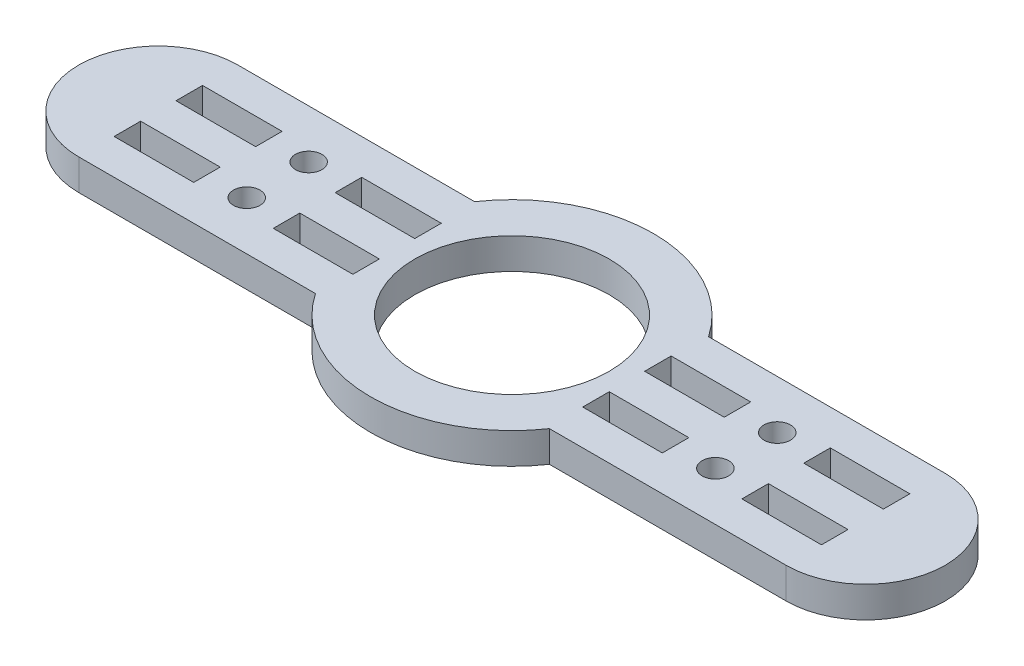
SolidWorks part; units mm, degrees
ref_plane "Front Plane" through (0, 0, 0) normal (0, 0, 1) x (1, 0, 0)
ref_plane "Top Plane" through (0, 0, 0) normal (0, 1, 0) x (1, 0, 0)
ref_plane "Right Plane" through (0, 0, 0) normal (1, 0, 0) x (0, 0, -1)
sketch "Sketch1" plane through (0, 0, 0) normal (0, 1, 0) x (1, 0, 0)
  line L0 (-40, 0) -> (40, 0) construction
  line L1 (-40, 9) -> (40, 9)
  line L2 (-40, -9) -> (40, -9)
  line L3 (-1032.6502, 3.5) -> (48967.3498, 3.5) construction
  line L4 (-1032.6502, -3.5) -> (48967.3498, -3.5) construction
  line L5 (-1000, 0) -> (49000, 0) construction
  line L6 (-22, -5) -> (-13, -5)
  line L7 (-22, -5) -> (-22, -2)
  line L8 (-22, -2) -> (-13, -2)
  line L9 (-13, -5) -> (-13, -2)
  line L10 (-22, -5) -> (-13, -2) construction
  line L11 (-22, -2) -> (-13, -5) construction
  line L12 (-40, -5) -> (-31, -5)
  line L13 (-40, -5) -> (-40, -2)
  line L14 (-40, -2) -> (-31, -2)
  line L15 (-31, -5) -> (-31, -2)
  line L16 (-40, -5) -> (-31, -2) construction
  line L17 (-40, -2) -> (-31, -5) construction
  line L18 (-40, 2) -> (-31, 5) construction
  line L19 (-40, 5) -> (-31, 2) construction
  line L20 (-22, 2) -> (-13, 5) construction
  line L21 (-22, 5) -> (-13, 2) construction
  line L22 (-31, 5) -> (-31, 2)
  line L23 (-40, 2) -> (-31, 2)
  line L24 (-40, 5) -> (-40, 2)
  line L25 (-40, 5) -> (-31, 5)
  line L26 (-13, 5) -> (-13, 2)
  line L27 (-22, 2) -> (-13, 2)
  line L28 (-22, 5) -> (-22, 2)
  line L29 (-22, 5) -> (-13, 5)
  line L30 (0, -1000) -> (0, 49000) construction
  line L31 (22, 5) -> (13, 2) construction
  line L32 (22, 2) -> (13, 5) construction
  line L33 (40, 5) -> (31, 2) construction
  line L34 (40, 2) -> (31, 5) construction
  line L35 (40, -2) -> (31, -5) construction
  line L36 (40, -5) -> (31, -2) construction
  line L37 (22, -2) -> (13, -5) construction
  line L38 (22, -5) -> (13, -2) construction
  line L39 (22, 5) -> (13, 5)
  line L40 (22, 5) -> (22, 2)
  line L41 (22, 2) -> (13, 2)
  line L42 (13, 5) -> (13, 2)
  line L43 (40, 5) -> (31, 5)
  line L44 (40, 5) -> (40, 2)
  line L45 (40, 2) -> (31, 2)
  line L46 (31, 5) -> (31, 2)
  line L47 (31, -5) -> (31, -2)
  line L48 (40, -2) -> (31, -2)
  line L49 (40, -5) -> (40, -2)
  line L50 (40, -5) -> (31, -5)
  line L51 (13, -5) -> (13, -2)
  line L52 (22, -2) -> (13, -2)
  line L53 (22, -5) -> (22, -2)
  line L54 (22, -5) -> (13, -5)
  circle A0 centre (0, 0) radius 11
  arc A1 (13.2288, 9) -> (-13.2288, 9) centre (0, 0) ccw
  arc A2 (-40, 9) -> (-40, -9) centre (-40, 0) ccw
  arc A3 (40, -9) -> (40, 9) centre (40, 0) ccw
  circle A4 centre (0, 0) radius 11 construction
  arc A5 (-13.2288, -9) -> (13.2288, -9) centre (0, 0) ccw
  circle A6 centre (-26.5, 3.5) radius 1.5
  circle A7 centre (-26.5, -3.5) radius 1.5
  circle A8 centre (26.5, -3.5) radius 1.5
  circle A9 centre (26.5, 3.5) radius 1.5
  point P6 (0, 0)
  point P17 (-17.5, -3.5)
  point P24 (-35.5, -3.5)
  point P39 (-35.5, 3.5)
  point P40 (-17.5, 3.5)
  point P67 (17.5, 3.5)
  point P68 (35.5, 3.5)
  point P69 (35.5, -3.5)
  point P70 (17.5, -3.5)
  dimension "D1" = 22
  dimension "D3" = 7
  dimension "D5" = 22
  dimension "D6" = 16
  dimension "D12" = 3
  dimension "D13" = 3
  dimension "D2" = 80
  dimension "D4" = 3.5
  dimension "D7" = 9
  dimension "D8" = 9
  dimension "D9" = 3
  dimension "D10" = 9
  dimension "D11" = 4.5
  dimension "D14" = 18
  dimension "D15" = 13
extrude "Boss-Extrude1" add sketch "Sketch1" along normal blind 3.5 contours L2 A3 L1 A2 A8 A7 A6 L53 L54 L51 L52 L49 L50 L47 L48 L28 L29 L26 L27 L24 L25 L22 L23 L9 L6 L7 L8 L15 L12 L13 L14 L42 L39 L40 L41 L46 | L1 A1 | L2 A5 | L2 A3 L1 A0 A8 L53 L54 L51 L52 L49 L50 L47 L48 L42 L39 L40 L41 L46 L43 L44 L45 A9
